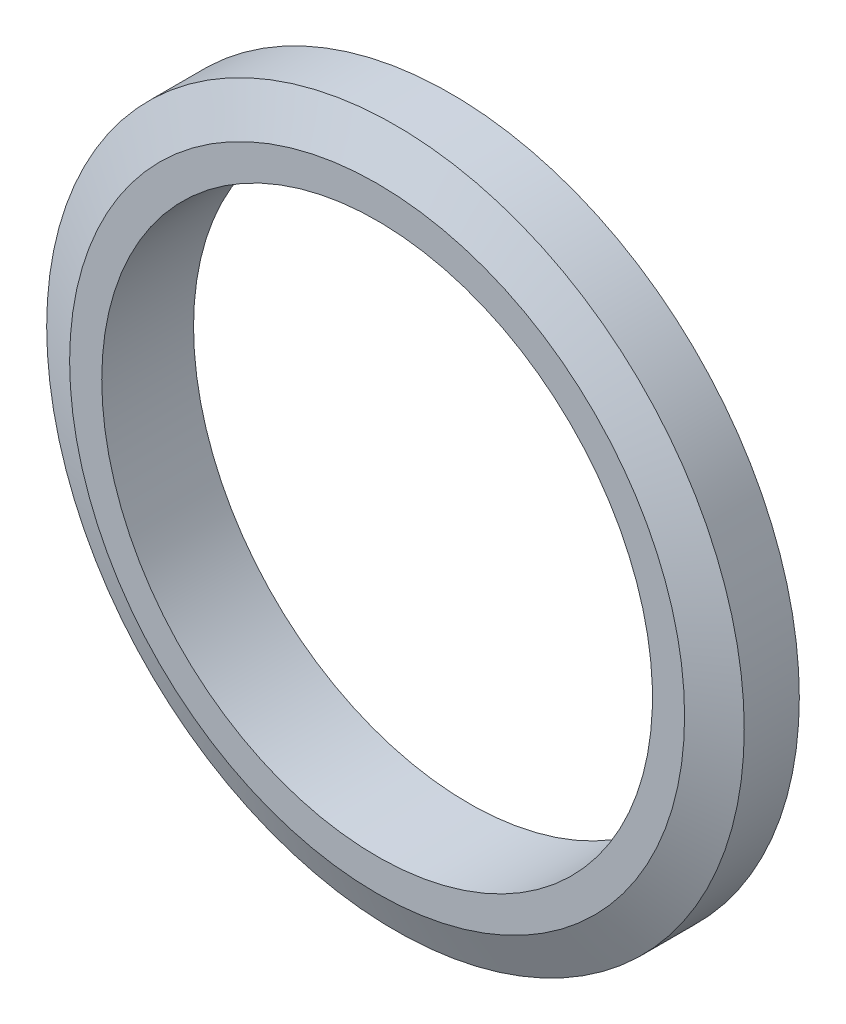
SolidWorks part; units mm, degrees
ref_plane "Front Plane" through (0, 0, 0) normal (0, 0, 1) x (1, 0, 0)
ref_plane "Top Plane" through (0, 0, 0) normal (0, 1, 0) x (1, 0, 0)
ref_plane "Right Plane" through (0, 0, 0) normal (1, 0, 0) x (0, 0, -1)
ref_plane "Plane1" through (0, 295, 0) normal (0, -1, 0) x (1, 0, 0)
sketch "Sketch1" plane through (0, 295, 0) normal (0, -1, 0) x (1, 0, 0)
  line L0 (67.6, 15.4) -> (67.6, 16.6)
  line L1 (67.6, 16.6) -> (66.7, 17)
  line L2 (66.7, 17) -> (66, 17)
  line L3 (66, 17) -> (66, 15)
  line L4 (66, 15) -> (66.7, 15)
  line L5 (66.7, 15) -> (67.6, 15.4)
  line L6 (60, 17) -> (60, 15) construction
revolve "Revolve1" add sketch "Sketch1" angle 360 about L6
